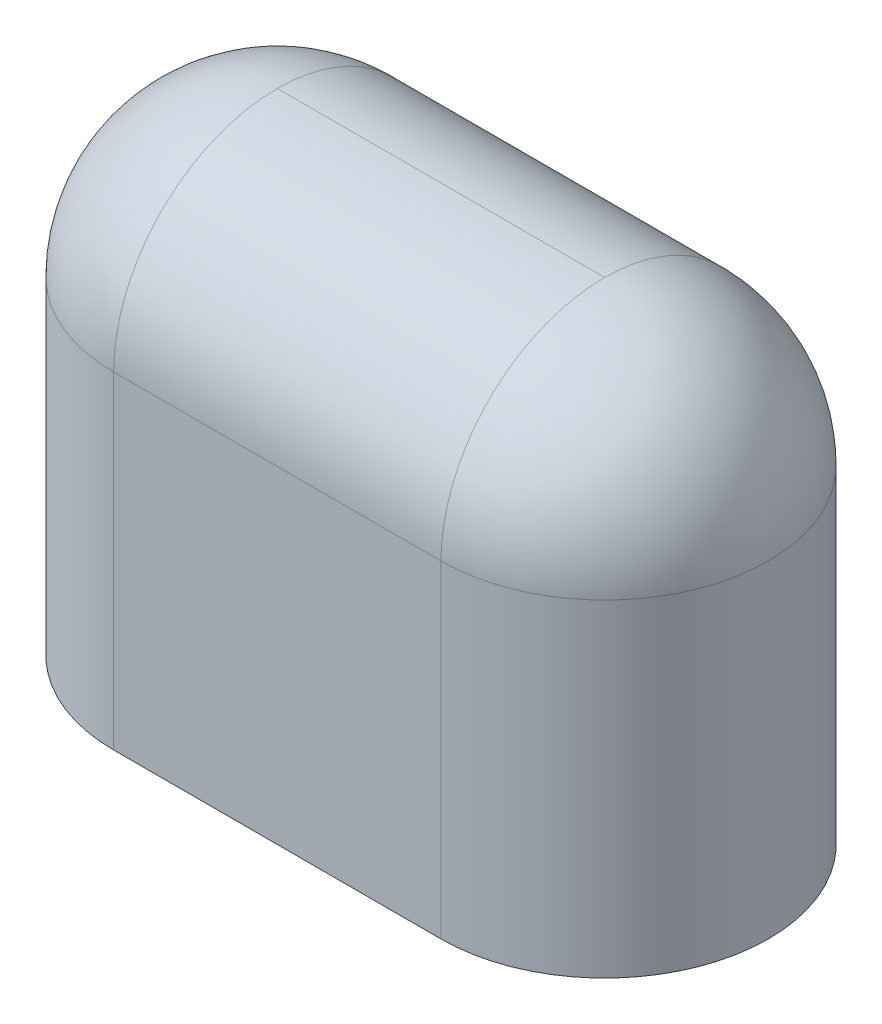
SolidWorks part; units mm, degrees
ref_plane "前视基准面" through (0, 0, 0) normal (0, 0, 1) x (1, 0, 0)
ref_plane "上视基准面" through (0, 0, 0) normal (0, 1, 0) x (1, 0, 0)
ref_plane "右视基准面" through (0, 0, 0) normal (1, 0, 0) x (0, 0, -1)
sketch "草图1" plane through (0, 0, 0) normal (0, 1, 0) x (1, 0, 0)
  line L0 (-3, 0) -> (3, 0) construction
  line L1 (-3, 3) -> (3, 3)
  line L2 (-3, -3) -> (3, -3)
  arc A0 (-3, 3) -> (-3, -3) centre (-3, 0) ccw
  arc A1 (3, -3) -> (3, 3) centre (3, 0) ccw
  point P2 (0, 0)
  dimension "D2" = 12
  dimension "D1" = 6
extrude "凸台-拉伸1" add sketch "草图1" along normal blind 9
fillet "圆角1" radius 3 4 edges at (0, 9, 3) (-6, 9, 0) (0, 9, -3) (6, 9, 0)
